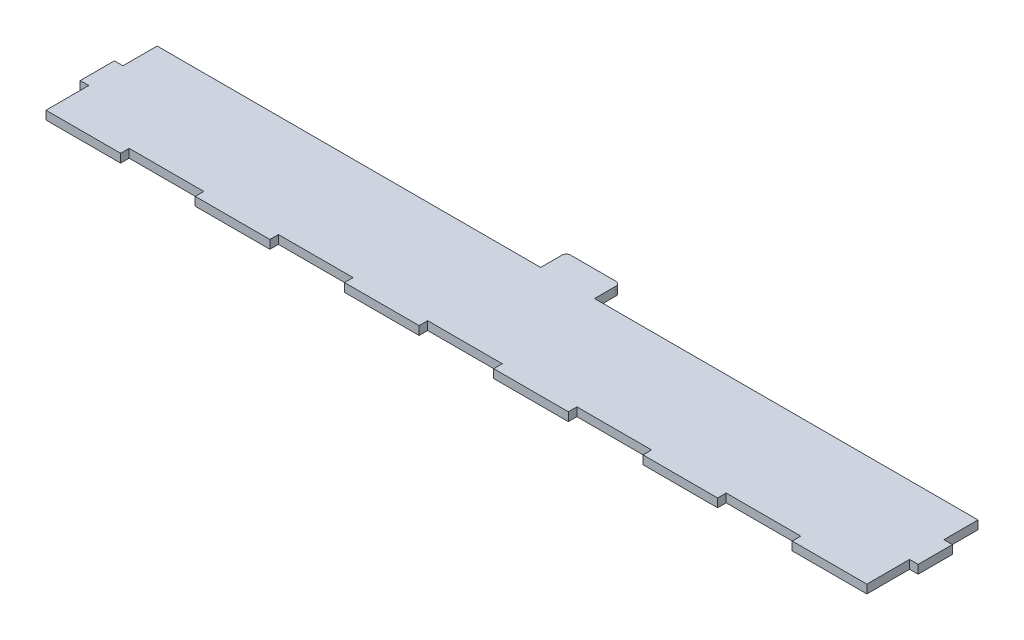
SolidWorks part; units mm, degrees
ref_plane "Front Plane" through (0, 0, 0) normal (0, 0, 1) x (1, 0, 0)
ref_plane "Top Plane" through (0, 0, 0) normal (0, 1, 0) x (1, 0, 0)
ref_plane "Right Plane" through (0, 0, 0) normal (1, 0, 0) x (0, 0, -1)
sketch "Sketch1" plane through (0, 0, 0) normal (0, 1, 0) x (1, 0, 0)
  line L0 (-152.4, 38.1) -> (-10, 38.1)
  line L1 (152.4, 38.1) -> (152.4, 25.4)
  line L2 (152.4, 25.4) -> (155.575, 25.4)
  line L3 (155.575, 25.4) -> (155.575, 12.7)
  line L4 (155.575, 12.7) -> (152.4, 12.7)
  line L5 (152.4, 12.7) -> (152.4, -3.175)
  line L6 (152.4, -3.175) -> (124.6909, -3.175)
  line L7 (124.6909, -3.175) -> (124.6909, 0)
  line L8 (124.6909, 0) -> (96.9818, 0)
  line L9 (96.9818, 0) -> (96.9818, -3.175)
  line L10 (96.9818, -3.175) -> (69.2727, -3.175)
  line L11 (69.2727, -3.175) -> (69.2727, 0)
  line L12 (69.2727, 0) -> (41.5636, 0)
  line L13 (41.5636, 0) -> (41.5636, -3.175)
  line L14 (41.5636, -3.175) -> (13.8545, -3.175)
  line L15 (13.8545, -3.175) -> (13.8545, 0)
  line L16 (13.8545, 0) -> (-13.8545, 0)
  line L17 (-13.8545, 0) -> (-13.8545, -3.175)
  line L18 (-13.8545, -3.175) -> (-41.5636, -3.175)
  line L19 (-41.5636, -3.175) -> (-41.5636, 0)
  line L20 (-41.5636, 0) -> (-69.2727, 0)
  line L21 (-69.2727, 0) -> (-69.2727, -3.175)
  line L22 (-69.2727, -3.175) -> (-96.9818, -3.175)
  line L23 (-96.9818, -3.175) -> (-96.9818, 0)
  line L24 (-96.9818, 0) -> (-124.6909, 0)
  line L25 (-124.6909, 0) -> (-124.6909, -3.175)
  line L26 (-124.6909, -3.175) -> (-152.4, -3.175)
  line L27 (-152.4, -3.175) -> (-152.4, 12.7)
  line L28 (-152.4, 12.7) -> (-155.575, 12.7)
  line L29 (-155.575, 12.7) -> (-155.575, 25.4)
  line L30 (-155.575, 25.4) -> (-152.4, 25.4)
  line L31 (-152.4, 25.4) -> (-152.4, 38.1)
  line L32 (0, 0) -> (0, 12.7) construction
  line L33 (0, 12.7) -> (0, 25.4) construction
  line L34 (0, 25.4) -> (0, 38.1) construction
  line L35 (152.4, 38.1) -> (10, 38.1)
  line L36 (-10, 38.1) -> (-10, 46.0375)
  line L37 (10, 38.1) -> (10, 46.0375)
  line L38 (-8.4125, 47.625) -> (8.4125, 47.625)
  line L39 (-10, 38.1) -> (10, 38.1) construction
  arc A0 (-10, 46.0375) -> (-8.4125, 47.625) centre (-8.4125, 46.0375) cw
  arc A1 (8.4125, 47.625) -> (10, 46.0375) centre (8.4125, 46.0375) cw
extrude "Boss-Extrude1" add sketch "Sketch1" along normal blind 3.175
equation "\"D1@Sketch1\" = \"matThickness\""
equation "\"innerWidth\"= 12in"
equation "\"innerDepth\" = 1in"
equation "\"innerHeight\"= 1.5in"
equation "\"matThickness\"= .125in"
equation "\"latchWidth\"=20mm"
equation "\"D2@Sketch1\"=\"innerHeight\""
equation "\"D3@Sketch1\"=\"innerWidth\""
equation "\"D4@Sketch1\"=\"latchWidth\""
equation "\"D5@Sketch1\"=\"matThickness\" * 3"
equation "\"D6@Sketch1\"=\"matThickness\" / 2"
equation "\"D1@Boss-Extrude1\"=\"matThickness\""
